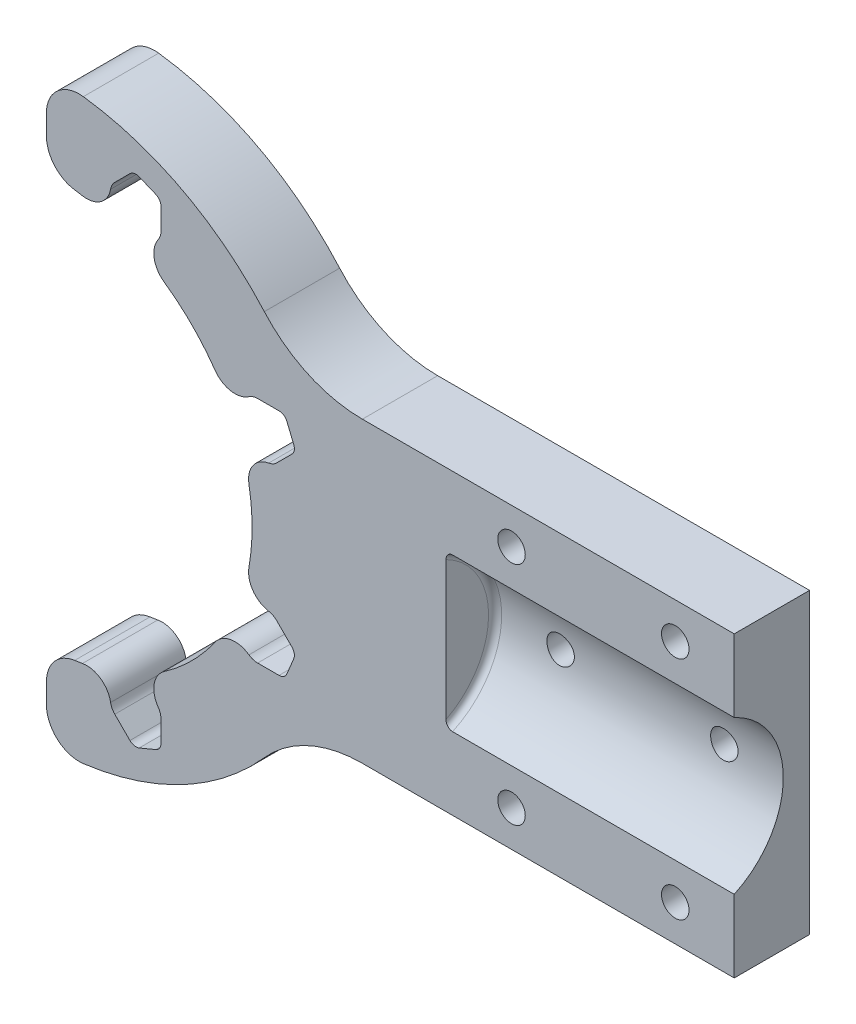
SolidWorks part; units mm, degrees
other "Markup1"
sketch "Sketch14" plane through (50, 44.1319, -20.15) normal (0.4469, 0.6037, -0.6602) x (0.6024, -0.7487, -0.2768)
ref_plane "Front Plane" through (0, 0, 0) normal (1, 0, 0) x (0, 1, 0)
ref_plane "Top Plane" through (0, 0, 0) normal (0, 0, 1) x (0, 1, 0)
ref_plane "Right Plane" through (0, 0, 0) normal (0, 1, 0) x (-1, 0, 0)
sketch "Sketch1" plane through (0, 0, 0) normal (1, 0, 0) x (0, 1, 0)
  line L0 (-11.6833, 0) -> (-22.75, 0)
  line L1 (-22.75, 0) -> (-22.75, -11.5)
  line L2 (-22.75, -11.5) -> (22.75, -11.5)
  line L3 (11.6833, 0) -> (22.75, 0)
  line L4 (22.75, 0) -> (22.75, -11.5)
  arc A0 (-11.6833, 0) -> (11.6833, 0) centre (0, 5.35) ccw
  circle A3 centre (0, 5.35) radius 12.85 construction
  point P7 (0, -11.5)
  dimension "D1" = 12.85
  dimension "D3" = 4
  dimension "D2" = 45.5
  dimension "D4" = 5.35
  dimension "D5" = 11.5
extrude "Boss-Extrude1" add sketch "Sketch1" along normal blind 50
sketch "Sketch3" plane through (0, 0, 0) normal (0, 0, 1) x (1, 0, 0)
  line L0 (0, 22.75) -> (-16.8131, 22.75)
  line L1 (0, 0) -> (-55, 0) construction
  line L2 (0, 11.6833) -> (0, -11.6833) construction
  line L3 (-55, 44.45) -> (-55, -44.45)
  line L4 (0, 22.75) -> (0, -22.75)
  line L5 (0, -22.75) -> (-16.8131, -22.75)
  arc A0 (-55, 44.45) -> (-16.8131, 22.75) centre (-55, 0) cw
  arc A1 (-16.8131, -22.75) -> (-55, -44.45) centre (-55, 0) cw
  point P9 (-55, 0)
  dimension "D2" = 44.45
  dimension "D1" = 55
extrude "Boss-Extrude2" add sketch "Sketch3" against normal blind 11.5
sketch "Sketch4" plane through (0, 0, 0) normal (1, 0, 0) x (0, 1, 0)
  line L2 (11.6833, 0) -> (-11.6833, 0)
  line L3 (11.6833, 0) -> (-11.6833, 0)
  arc A3 (-11.6833, 0) -> (11.6833, 0) centre (0, 5.35) ccw
  arc A4 (-11.6833, 0) -> (11.6833, 0) centre (0, 5.35) ccw
  dimension "D1" = 0
extrude "Boss-Extrude3" add sketch "Sketch4" along normal blind 6
sketch "Sketch5" plane through (0, 0, -11.5) normal (0, 0, -1) x (1, 0, 0)
  line L0 (-55, 0) -> (-17.5829, 15.4987) construction
  line L1 (-55, -44.45) -> (-55, 44.45) construction
  line L2 (-55, 0) -> (0, 0) construction
  line L3 (-18.1049, 16.759) -> (-17.0608, 14.2383)
  line L4 (-19.4907, 17.685) -> (-22.7607, 17.685)
  line L5 (-17.386, 12.6037) -> (-19.6982, 10.2914)
  line L6 (-55, 31.6) -> (-55, -31.6)
  line L7 (-55, 0) -> (-32.6554, 22.3446) construction
  line L8 (-42.3963, 37.614) -> (-44.7086, 35.3018)
  line L9 (-38.241, 36.8951) -> (-40.7617, 37.9392)
  line L10 (-37.315, 35.5093) -> (-37.315, 32.2393)
  line L11 (-17.386, -12.6037) -> (-19.6982, -10.2914)
  line L12 (-18.1049, -16.759) -> (-17.0608, -14.2383)
  line L13 (-19.4907, -17.685) -> (-22.7607, -17.685)
  line L14 (-37.315, -35.5093) -> (-37.315, -32.2393)
  line L15 (-38.241, -36.8951) -> (-40.7617, -37.9392)
  line L16 (-42.3963, -37.614) -> (-44.7086, -35.3018)
  arc A0 (-55, 31.6) -> (-49.4658, 31.1116) centre (-55, 0) cw
  arc A1 (-18.1049, 16.759) -> (-19.4907, 17.685) centre (-19.4907, 16.185) ccw
  arc A2 (-22.7607, 17.685) -> (-24.201, 17.2284) centre (-22.7607, 15.185) ccw
  arc A3 (-29.0875, 18.086) -> (-24.201, 17.2284) centre (-26.2175, 20.0892) ccw
  arc A4 (-17.0608, 14.2383) -> (-17.386, 12.6037) centre (-18.4466, 13.6643) cw
  arc A5 (-19.6982, 10.2914) -> (-21.0395, 9.5958) centre (-21.466, 12.0592) cw
  arc A6 (-23.8884, 5.5342) -> (-21.0395, 9.5958) centre (-20.4425, 6.1471) cw
  arc A7 (-23.8884, 5.5342) -> (-23.8884, -5.5342) centre (-55, 0) cw
  arc A9 (-49.4658, 31.1116) -> (-45.4042, 33.9605) centre (-48.8529, 34.5575) ccw
  arc A10 (-44.7086, 35.3018) -> (-45.4042, 33.9605) centre (-42.9408, 33.534) ccw
  arc A11 (-40.7617, 37.9392) -> (-42.3963, 37.614) centre (-41.3357, 36.5534) ccw
  arc A12 (-38.241, 36.8951) -> (-37.315, 35.5093) centre (-38.815, 35.5093) cw
  arc A13 (-37.315, 32.2393) -> (-37.7716, 30.799) centre (-39.815, 32.2393) cw
  arc A14 (-36.914, 25.9125) -> (-37.7716, 30.799) centre (-34.9108, 28.7825) cw
  arc A15 (-36.914, 25.9125) -> (-29.0875, 18.086) centre (-55, 0) cw
  arc A16 (-23.8884, -5.5342) -> (-21.0395, -9.5958) centre (-20.4425, -6.1471) ccw
  arc A17 (-19.6982, -10.2914) -> (-21.0395, -9.5958) centre (-21.466, -12.0592) ccw
  arc A18 (-17.0608, -14.2383) -> (-17.386, -12.6037) centre (-18.4466, -13.6643) ccw
  arc A19 (-18.1049, -16.759) -> (-19.4907, -17.685) centre (-19.4907, -16.185) cw
  arc A20 (-22.7607, -17.685) -> (-24.201, -17.2284) centre (-22.7607, -15.185) cw
  arc A21 (-29.0875, -18.086) -> (-24.201, -17.2284) centre (-26.2175, -20.0892) cw
  arc A22 (-36.914, -25.9125) -> (-37.7716, -30.799) centre (-34.9108, -28.7825) ccw
  arc A23 (-37.315, -32.2393) -> (-37.7716, -30.799) centre (-39.815, -32.2393) ccw
  arc A24 (-38.241, -36.8951) -> (-37.315, -35.5093) centre (-38.815, -35.5093) ccw
  arc A25 (-40.7617, -37.9392) -> (-42.3963, -37.614) centre (-41.3357, -36.5534) cw
  arc A26 (-44.7086, -35.3018) -> (-45.4042, -33.9605) centre (-42.9408, -33.534) cw
  arc A27 (-49.4658, -31.1116) -> (-45.4042, -33.9605) centre (-48.8529, -34.5575) cw
  arc A28 (-29.0875, -18.086) -> (-36.914, -25.9125) centre (-55, 0) cw
  arc A29 (-49.4658, -31.1116) -> (-55, -31.6) centre (-55, 0) cw
  point P9 (-17.5829, 15.4987)
  dimension "D3" = 31.6
  dimension "D4" = 1.5
  dimension "D6" = 2.5
  dimension "D7" = 3.5
  dimension "D1" = 40.5
  dimension "D2" = 22.5
  dimension "D5" = 3.27
  dimension "D8" = 5.5
  dimension "D9" = 45
extrude "Cut-Extrude1" cut sketch "Sketch5" against normal through all
fillet "Fillet6" radius 20 2 edges at (-16.8131, -22.75, -5.75) (-16.8131, 22.75, -5.75)
fillet "Fillet7" radius 1 1 edges at (6, 0, -7.5)
sketch "Sketch6" plane through (0, 0, 0) normal (0, 0, 1) x (1, 0, 0)
  line L0 (50, 11.6833) -> (7, 11.6833) construction
  line L1 (41, 17.25) -> (16, 17.25) construction
  line L2 (50, 22.75) -> (50, 11.6833) construction
  line L4 (41, 17.25) -> (41, -17.25) construction
  circle A0 centre (41, 17.25) radius 2.1
  circle A1 centre (16, 17.25) radius 2.1
  circle A2 centre (16, -17.25) radius 2.1
  circle A3 centre (41, -17.25) radius 2.1
  point P10 (28.5, 11.6833)
  point P11 (28.5, 17.25)
  point P15 (41, 0)
  dimension "D2" = 4.2
  dimension "D4" = 34.5
  dimension "D1" = 25
  dimension "D3" = 9
extrude "Cut-Extrude2" cut sketch "Sketch6" against normal through all
sketch "Sketch8" plane through (0, 0, 0) normal (0, 0, 1) x (1, 0, 0)
  line L126 (-22.7607, -17.485) -> (-19.4907, -17.485)
  line L127 (-18.2897, -16.6825) -> (-17.2456, -14.1618)
  line L128 (-17.5274, -12.7451) -> (-19.8396, -10.4328)
  line L129 (-19.8396, 10.4328) -> (-17.5274, 12.7451)
  line L130 (-17.2456, 14.1618) -> (-18.2897, 16.6825)
  line L131 (-19.4907, 17.485) -> (-22.7607, 17.485)
  line L132 (-37.515, 32.2393) -> (-37.515, 35.5093)
  line L133 (-38.3175, 36.7103) -> (-40.8382, 37.7544)
  line L134 (-42.2549, 37.4726) -> (-44.5672, 35.1604)
  line L135 (-22.7607, -17.485) -> (-19.4907, -17.485)
  line L136 (-18.2897, -16.6825) -> (-17.2456, -14.1618)
  line L137 (-17.5274, -12.7451) -> (-19.8396, -10.4328)
  line L138 (-19.8396, 10.4328) -> (-17.5274, 12.7451)
  line L139 (-17.2456, 14.1618) -> (-18.2897, 16.6825)
  line L140 (-19.4907, 17.485) -> (-22.7607, 17.485)
  line L141 (-37.515, 32.2393) -> (-37.515, 35.5093)
  line L142 (-38.3175, 36.7103) -> (-40.8382, 37.7544)
  line L143 (-42.2549, 37.4726) -> (-44.5672, 35.1604)
  line L156 (-44.5672, -35.1604) -> (-42.2549, -37.4726)
  line L157 (-40.8382, -37.7544) -> (-38.3175, -36.7103)
  line L158 (-37.515, -35.5093) -> (-37.515, -32.2393)
  line L159 (-44.5672, -35.1604) -> (-42.2549, -37.4726)
  line L160 (-40.8382, -37.7544) -> (-38.3175, -36.7103)
  line L161 (-37.515, -35.5093) -> (-37.515, -32.2393)
  line L201 (-55, -31.4) -> (-55, -31.6)
  line L202 (-55, 31.6) -> (-55, 31.4)
  line L203 (-55, -31.6) -> (-55, -44.45) construction
  line L204 (-55, 44.45) -> (-55, 31.6) construction
  line L222 (-55, -31.6) -> (-55, -44.45)
  line L223 (-6.7689, -22.75) -> (50, -22.75)
  line L224 (50, -22.75) -> (50, -11.6833)
  line L225 (50, -11.6833) -> (7, -11.6833)
  line L226 (6, -10.5736) -> (6, 10.5736)
  line L227 (7, 11.6833) -> (50, 11.6833)
  line L228 (50, 11.6833) -> (50, 22.75)
  line L229 (50, 22.75) -> (-6.7689, 22.75)
  line L230 (-55, 44.45) -> (-55, 31.6)
  line L231 (-44.7086, 35.3018) -> (-42.3963, 37.614)
  line L232 (-40.7617, 37.9392) -> (-38.241, 36.8951)
  line L233 (-37.315, 35.5093) -> (-37.315, 32.2393)
  line L234 (-22.7607, 17.685) -> (-19.4907, 17.685)
  line L235 (-18.1049, 16.759) -> (-17.0608, 14.2383)
  line L236 (-17.386, 12.6037) -> (-19.6982, 10.2914)
  line L237 (-19.6982, -10.2914) -> (-17.386, -12.6037)
  line L238 (-17.0608, -14.2383) -> (-18.1049, -16.759)
  line L239 (-19.4907, -17.685) -> (-22.7607, -17.685)
  line L240 (-37.315, -32.2393) -> (-37.315, -35.5093)
  line L241 (-38.241, -36.8951) -> (-40.7617, -37.9392)
  line L242 (-42.3963, -37.614) -> (-44.7086, -35.3018)
  line L245 (50, -22.75) -> (50, -11.6833)
  line L246 (50, -11.6833) -> (7, -11.6833)
  line L247 (6, -10.5736) -> (6, 10.5736)
  line L248 (7, 11.6833) -> (50, 11.6833)
  line L249 (50, 11.6833) -> (50, 22.75)
  line L252 (-44.7086, 35.3018) -> (-42.3963, 37.614)
  line L253 (-40.7617, 37.9392) -> (-38.241, 36.8951)
  line L254 (-37.315, 35.5093) -> (-37.315, 32.2393)
  line L255 (-22.7607, 17.685) -> (-19.4907, 17.685)
  line L256 (-18.1049, 16.759) -> (-17.0608, 14.2383)
  line L257 (-17.386, 12.6037) -> (-19.6982, 10.2914)
  line L258 (-19.6982, -10.2914) -> (-17.386, -12.6037)
  line L259 (-17.0608, -14.2383) -> (-18.1049, -16.759)
  line L260 (-19.4907, -17.685) -> (-22.7607, -17.685)
  line L261 (-37.315, -32.2393) -> (-37.315, -35.5093)
  line L262 (-38.241, -36.8951) -> (-40.7617, -37.9392)
  line L263 (-42.3963, -37.614) -> (-44.7086, -35.3018)
  arc A308 (-19.4907, -17.485) -> (-18.2897, -16.6825) centre (-19.4907, -16.185) ccw
  arc A309 (-17.2456, -14.1618) -> (-17.5274, -12.7451) centre (-18.4466, -13.6643) ccw
  arc A310 (-19.8396, -10.4328) -> (-21.0736, -9.7929) centre (-21.466, -12.0592) ccw
  arc A311 (-24.0853, -5.4991) -> (-21.0736, -9.7929) centre (-20.4425, -6.1471) ccw
  arc A312 (-24.0853, -5.4991) -> (-24.0853, 5.4991) centre (-55, 0) ccw
  arc A313 (-21.0736, 9.7929) -> (-24.0853, 5.4991) centre (-20.4425, 6.1471) ccw
  arc A314 (-21.0736, 9.7929) -> (-19.8396, 10.4328) centre (-21.466, 12.0592) ccw
  arc A315 (-17.5274, 12.7451) -> (-17.2456, 14.1618) centre (-18.4466, 13.6643) ccw
  arc A316 (-18.2897, 16.6825) -> (-19.4907, 17.485) centre (-19.4907, 16.185) ccw
  arc A317 (-22.7607, 17.485) -> (-24.0858, 17.0649) centre (-22.7607, 15.185) ccw
  arc A318 (-29.2515, 17.9715) -> (-24.0858, 17.0649) centre (-26.2175, 20.0892) ccw
  arc A319 (-29.2515, 17.9715) -> (-37.0285, 25.7485) centre (-55, 0) ccw
  arc A320 (-37.9351, 30.9142) -> (-37.0285, 25.7485) centre (-34.9108, 28.7825) ccw
  arc A321 (-37.9351, 30.9142) -> (-37.515, 32.2393) centre (-39.815, 32.2393) ccw
  arc A322 (-37.515, 35.5093) -> (-38.3175, 36.7103) centre (-38.815, 35.5093) ccw
  arc A323 (-40.8382, 37.7544) -> (-42.2549, 37.4726) centre (-41.3357, 36.5534) ccw
  arc A324 (-44.5672, 35.1604) -> (-45.2071, 33.9264) centre (-42.9408, 33.534) ccw
  arc A325 (-49.5009, 30.9147) -> (-45.2071, 33.9264) centre (-48.8529, 34.5575) ccw
  arc A326 (-49.5009, 30.9147) -> (-55, 31.4) centre (-55, 0) ccw
  arc A327 (-19.4907, -17.485) -> (-18.2897, -16.6825) centre (-19.4907, -16.185) ccw
  arc A328 (-17.2456, -14.1618) -> (-17.5274, -12.7451) centre (-18.4466, -13.6643) ccw
  arc A329 (-19.8396, -10.4328) -> (-21.0736, -9.7929) centre (-21.466, -12.0592) ccw
  arc A330 (-24.0853, -5.4991) -> (-21.0736, -9.7929) centre (-20.4425, -6.1471) ccw
  arc A331 (-24.0853, -5.4991) -> (-24.0853, 5.4991) centre (-55, 0) ccw
  arc A332 (-21.0736, 9.7929) -> (-24.0853, 5.4991) centre (-20.4425, 6.1471) ccw
  arc A333 (-21.0736, 9.7929) -> (-19.8396, 10.4328) centre (-21.466, 12.0592) ccw
  arc A334 (-17.5274, 12.7451) -> (-17.2456, 14.1618) centre (-18.4466, 13.6643) ccw
  arc A335 (-18.2897, 16.6825) -> (-19.4907, 17.485) centre (-19.4907, 16.185) ccw
  arc A336 (-22.7607, 17.485) -> (-24.0858, 17.0649) centre (-22.7607, 15.185) ccw
  arc A337 (-29.2515, 17.9715) -> (-24.0858, 17.0649) centre (-26.2175, 20.0892) ccw
  arc A338 (-29.2515, 17.9715) -> (-37.0285, 25.7485) centre (-55, 0) ccw
  arc A339 (-37.9351, 30.9142) -> (-37.0285, 25.7485) centre (-34.9108, 28.7825) ccw
  arc A340 (-37.9351, 30.9142) -> (-37.515, 32.2393) centre (-39.815, 32.2393) ccw
  arc A341 (-37.515, 35.5093) -> (-38.3175, 36.7103) centre (-38.815, 35.5093) ccw
  arc A342 (-40.8382, 37.7544) -> (-42.2549, 37.4726) centre (-41.3357, 36.5534) ccw
  arc A343 (-44.5672, 35.1604) -> (-45.2071, 33.9264) centre (-42.9408, 33.534) ccw
  arc A344 (-49.5009, 30.9147) -> (-45.2071, 33.9264) centre (-48.8529, 34.5575) ccw
  arc A345 (-49.5009, 30.9147) -> (-55, 31.4) centre (-55, 0) ccw
  arc A402 (-55, -31.6) -> (-49.4658, -31.1116) centre (-55, 0) ccw
  arc A403 (-55, -31.6) -> (-49.4658, -31.1116) centre (-55, 0) ccw
  arc A410 (-55, -31.4) -> (-49.5009, -30.9147) centre (-55, 0) ccw
  arc A411 (-45.2071, -33.9264) -> (-49.5009, -30.9147) centre (-48.8529, -34.5575) ccw
  arc A412 (-45.2071, -33.9264) -> (-44.5672, -35.1604) centre (-42.9408, -33.534) ccw
  arc A413 (-42.2549, -37.4726) -> (-40.8382, -37.7544) centre (-41.3357, -36.5534) ccw
  arc A414 (-38.3175, -36.7103) -> (-37.515, -35.5093) centre (-38.815, -35.5093) ccw
  arc A415 (-37.515, -32.2393) -> (-37.9351, -30.9142) centre (-39.815, -32.2393) ccw
  arc A416 (-37.0285, -25.7485) -> (-37.9351, -30.9142) centre (-34.9108, -28.7825) ccw
  arc A417 (-37.0285, -25.7485) -> (-29.2515, -17.9715) centre (-55, 0) ccw
  arc A418 (-24.0858, -17.0649) -> (-29.2515, -17.9715) centre (-26.2175, -20.0892) ccw
  arc A419 (-24.0858, -17.0649) -> (-22.7607, -17.485) centre (-22.7607, -15.185) ccw
  arc A420 (-55, -31.4) -> (-49.5009, -30.9147) centre (-55, 0) ccw
  arc A421 (-45.2071, -33.9264) -> (-49.5009, -30.9147) centre (-48.8529, -34.5575) ccw
  arc A422 (-45.2071, -33.9264) -> (-44.5672, -35.1604) centre (-42.9408, -33.534) ccw
  arc A423 (-42.2549, -37.4726) -> (-40.8382, -37.7544) centre (-41.3357, -36.5534) ccw
  arc A424 (-38.3175, -36.7103) -> (-37.515, -35.5093) centre (-38.815, -35.5093) ccw
  arc A425 (-37.515, -32.2393) -> (-37.9351, -30.9142) centre (-39.815, -32.2393) ccw
  arc A426 (-37.0285, -25.7485) -> (-37.9351, -30.9142) centre (-34.9108, -28.7825) ccw
  arc A427 (-37.0285, -25.7485) -> (-29.2515, -17.9715) centre (-55, 0) ccw
  arc A428 (-24.0858, -17.0649) -> (-29.2515, -17.9715) centre (-26.2175, -20.0892) ccw
  arc A429 (-24.0858, -17.0649) -> (-22.7607, -17.485) centre (-22.7607, -15.185) ccw
  arc A522 (-45.4042, -33.9605) -> (-49.4658, -31.1116) centre (-48.8529, -34.5575) ccw
  arc A523 (-55, -31.6) -> (-49.4658, -31.1116) centre (-55, 0) ccw
  arc A524 (-55, -44.45) -> (-21.7359, -29.4839) centre (-55, 0) ccw
  arc A525 (-6.7689, -22.75) -> (-21.7359, -29.4839) centre (-6.7689, -42.75) ccw
  arc A526 (-21.7359, 29.4839) -> (-6.7689, 22.75) centre (-6.7689, 42.75) ccw
  arc A527 (-21.7359, 29.4839) -> (-55, 44.45) centre (-55, 0) ccw
  arc A528 (-49.4658, 31.1116) -> (-55, 31.6) centre (-55, 0) ccw
  arc A529 (-49.4658, 31.1116) -> (-45.4042, 33.9605) centre (-48.8529, 34.5575) ccw
  arc A530 (-44.7086, 35.3018) -> (-45.4042, 33.9605) centre (-42.9408, 33.534) ccw
  arc A531 (-40.7617, 37.9392) -> (-42.3963, 37.614) centre (-41.3357, 36.5534) ccw
  arc A532 (-37.315, 35.5093) -> (-38.241, 36.8951) centre (-38.815, 35.5093) ccw
  arc A533 (-37.7716, 30.799) -> (-37.315, 32.2393) centre (-39.815, 32.2393) ccw
  arc A534 (-37.7716, 30.799) -> (-36.914, 25.9125) centre (-34.9108, 28.7825) ccw
  arc A535 (-29.0875, 18.086) -> (-36.914, 25.9125) centre (-55, 0) ccw
  arc A536 (-29.0875, 18.086) -> (-24.201, 17.2284) centre (-26.2175, 20.0892) ccw
  arc A537 (-22.7607, 17.685) -> (-24.201, 17.2284) centre (-22.7607, 15.185) ccw
  arc A538 (-18.1049, 16.759) -> (-19.4907, 17.685) centre (-19.4907, 16.185) ccw
  arc A539 (-17.386, 12.6037) -> (-17.0608, 14.2383) centre (-18.4466, 13.6643) ccw
  arc A540 (-21.0395, 9.5958) -> (-19.6982, 10.2914) centre (-21.466, 12.0592) ccw
  arc A541 (-21.0395, 9.5958) -> (-23.8884, 5.5342) centre (-20.4425, 6.1471) ccw
  arc A542 (-23.8884, -5.5342) -> (-23.8884, 5.5342) centre (-55, 0) ccw
  arc A543 (-23.8884, -5.5342) -> (-21.0395, -9.5958) centre (-20.4425, -6.1471) ccw
  arc A544 (-19.6982, -10.2914) -> (-21.0395, -9.5958) centre (-21.466, -12.0592) ccw
  arc A545 (-17.0608, -14.2383) -> (-17.386, -12.6037) centre (-18.4466, -13.6643) ccw
  arc A546 (-19.4907, -17.685) -> (-18.1049, -16.759) centre (-19.4907, -16.185) ccw
  arc A547 (-24.201, -17.2284) -> (-22.7607, -17.685) centre (-22.7607, -15.185) ccw
  arc A548 (-24.201, -17.2284) -> (-29.0875, -18.086) centre (-26.2175, -20.0892) ccw
  arc A549 (-36.914, -25.9125) -> (-29.0875, -18.086) centre (-55, 0) ccw
  arc A550 (-36.914, -25.9125) -> (-37.7716, -30.799) centre (-34.9108, -28.7825) ccw
  arc A551 (-37.315, -32.2393) -> (-37.7716, -30.799) centre (-39.815, -32.2393) ccw
  arc A552 (-38.241, -36.8951) -> (-37.315, -35.5093) centre (-38.815, -35.5093) ccw
  arc A553 (-42.3963, -37.614) -> (-40.7617, -37.9392) centre (-41.3357, -36.5534) ccw
  arc A554 (-45.4042, -33.9605) -> (-44.7086, -35.3018) centre (-42.9408, -33.534) ccw
  arc A555 (-45.4042, -33.9605) -> (-49.4658, -31.1116) centre (-48.8529, -34.5575) ccw
  arc A556 (-55, -31.6) -> (-49.4658, -31.1116) centre (-55, 0) ccw
  arc A561 (-49.4658, 31.1116) -> (-55, 31.6) centre (-55, 0) ccw
  arc A562 (-49.4658, 31.1116) -> (-45.4042, 33.9605) centre (-48.8529, 34.5575) ccw
  arc A563 (-44.7086, 35.3018) -> (-45.4042, 33.9605) centre (-42.9408, 33.534) ccw
  arc A564 (-40.7617, 37.9392) -> (-42.3963, 37.614) centre (-41.3357, 36.5534) ccw
  arc A565 (-37.315, 35.5093) -> (-38.241, 36.8951) centre (-38.815, 35.5093) ccw
  arc A566 (-37.7716, 30.799) -> (-37.315, 32.2393) centre (-39.815, 32.2393) ccw
  arc A567 (-37.7716, 30.799) -> (-36.914, 25.9125) centre (-34.9108, 28.7825) ccw
  arc A568 (-29.0875, 18.086) -> (-36.914, 25.9125) centre (-55, 0) ccw
  arc A569 (-29.0875, 18.086) -> (-24.201, 17.2284) centre (-26.2175, 20.0892) ccw
  arc A570 (-22.7607, 17.685) -> (-24.201, 17.2284) centre (-22.7607, 15.185) ccw
  arc A571 (-18.1049, 16.759) -> (-19.4907, 17.685) centre (-19.4907, 16.185) ccw
  arc A572 (-17.386, 12.6037) -> (-17.0608, 14.2383) centre (-18.4466, 13.6643) ccw
  arc A573 (-21.0395, 9.5958) -> (-19.6982, 10.2914) centre (-21.466, 12.0592) ccw
  arc A574 (-21.0395, 9.5958) -> (-23.8884, 5.5342) centre (-20.4425, 6.1471) ccw
  arc A575 (-23.8884, -5.5342) -> (-23.8884, 5.5342) centre (-55, 0) ccw
  arc A576 (-23.8884, -5.5342) -> (-21.0395, -9.5958) centre (-20.4425, -6.1471) ccw
  arc A577 (-19.6982, -10.2914) -> (-21.0395, -9.5958) centre (-21.466, -12.0592) ccw
  arc A578 (-17.0608, -14.2383) -> (-17.386, -12.6037) centre (-18.4466, -13.6643) ccw
  arc A579 (-19.4907, -17.685) -> (-18.1049, -16.759) centre (-19.4907, -16.185) ccw
  arc A580 (-24.201, -17.2284) -> (-22.7607, -17.685) centre (-22.7607, -15.185) ccw
  arc A581 (-24.201, -17.2284) -> (-29.0875, -18.086) centre (-26.2175, -20.0892) ccw
  arc A582 (-36.914, -25.9125) -> (-29.0875, -18.086) centre (-55, 0) ccw
  arc A583 (-36.914, -25.9125) -> (-37.7716, -30.799) centre (-34.9108, -28.7825) ccw
  arc A584 (-37.315, -32.2393) -> (-37.7716, -30.799) centre (-39.815, -32.2393) ccw
  arc A585 (-38.241, -36.8951) -> (-37.315, -35.5093) centre (-38.815, -35.5093) ccw
  arc A586 (-42.3963, -37.614) -> (-40.7617, -37.9392) centre (-41.3357, -36.5534) ccw
  arc A587 (-45.4042, -33.9605) -> (-44.7086, -35.3018) centre (-42.9408, -33.534) ccw
  spline S6 degree 3 poles (-2509.1902, 1617.4644) (74.8781, 92.452) (14.5263, -15.4123) (6.4748, -11.5311) (6.3635, -11.4434) (6.1842, -11.234) (6.1149, -11.1114) (2.2458, -0.1287) (157.5697, 59.7873) (438.961, -2975.224) knots -15.702008 -15.702008 -15.702008 -15.702008 0.25 0.25 0.5 0.5 0.75 0.75 21.537794 21.537794 21.537794 21.537794 only from (7, -11.6833) to (6, -10.5736)
  spline S7 degree 3 poles (-2216.2851, 2016.2911) (470.859, -114.1931) (-0.4913, -7.6679) (6.115, 11.1119) (6.1825, 11.2319) (6.3638, 11.444) (6.4731, 11.5301) (15.0642, 15.682) (77.3735, -109.086) (-2475.6451, -1666.9153) knots -35.198245 -35.198245 -35.198245 -35.198245 0.25 0.25 0.5 0.5 0.75 0.75 17.674717 17.674717 17.674717 17.674717 only from (6, 10.5736) to (7, 11.6833)
  spline S8 degree 3 poles (7, -11.6833) (6.8604, -11.6833) (6.7233, -11.6509) (6.4748, -11.5311) (6.3635, -11.4434) (6.1842, -11.234) (6.1149, -11.1114) (6.023, -10.8504) (6, -10.7128) (6, -10.5736) knots 0 0 0 0 0.25 0.25 0.5 0.5 0.75 0.75 1 1 1 1
  spline S9 degree 3 poles (6, 10.5736) (6, 10.713) (6.0225, 10.8489) (6.115, 11.1119) (6.1825, 11.2319) (6.3638, 11.444) (6.4731, 11.5301) (6.7232, 11.651) (6.8601, 11.6833) (7, 11.6833) knots 0 0 0 0 0.25 0.25 0.5 0.5 0.75 0.75 1 1 1 1
  dimension "D1" = 0.2
  dimension "D2" = 0.2
  dimension "D3" = 0
  dimension "D4" = 0
extrude "Boss-Extrude4" add sketch "Sketch8" against normal up to surface (11.5 mm away) contours A555 A587 L263 A586 L262 A585 L261 A584 A583 A582 A581 A580 L260 A579 L259 A578 L258 A577 A576 A575 A574 A573 L257 A572 L256 A571 L255 A570 A569 A568 A567 A566 L254 A565 L253 A564 L252 A563 A562 A561 L202 A345 A344 A343 L143 A342 L142 A341 L141 A340 A339
fillet "Fillet11" radius 5 4 edges at (-55, 31.4, -5.75) (-55, 44.45, -5.75) (-55, -31.4, -5.75) (-55, -44.45, -5.75)
sketch "Sketch9" plane through (0, 0, -11.5) normal (0, 0, -1) x (1, 0, 0)
  line L0 (16, 17.25) -> (16, -17.25) construction
  line L1 (41, 17.25) -> (41, -17.25) construction
  circle A0 centre (16, 0) radius 2.1
  circle A1 centre (41, 0) radius 2.1
  dimension "D1" = 4.2
extrude "Cut-Extrude3" cut sketch "Sketch9" against normal through all and the other way through all
sketch "Sketch13" plane through (0, 0, -11.5) normal (0, 0, -1) x (1, 0, 0)
  line L0 (16, 0) -> (41, 0) construction
  circle A0 centre (28.5, 0) radius 5
  circle A1 centre (28.5, 0) radius 2.2
  dimension "D1" = 4.4
  dimension "D2" = 10
extrude "Boss-Extrude7" add sketch "Sketch13" along normal blind 9.65
fillet "Fillet13" radius 3 1 edges at (33.5, 0, -11.5)
